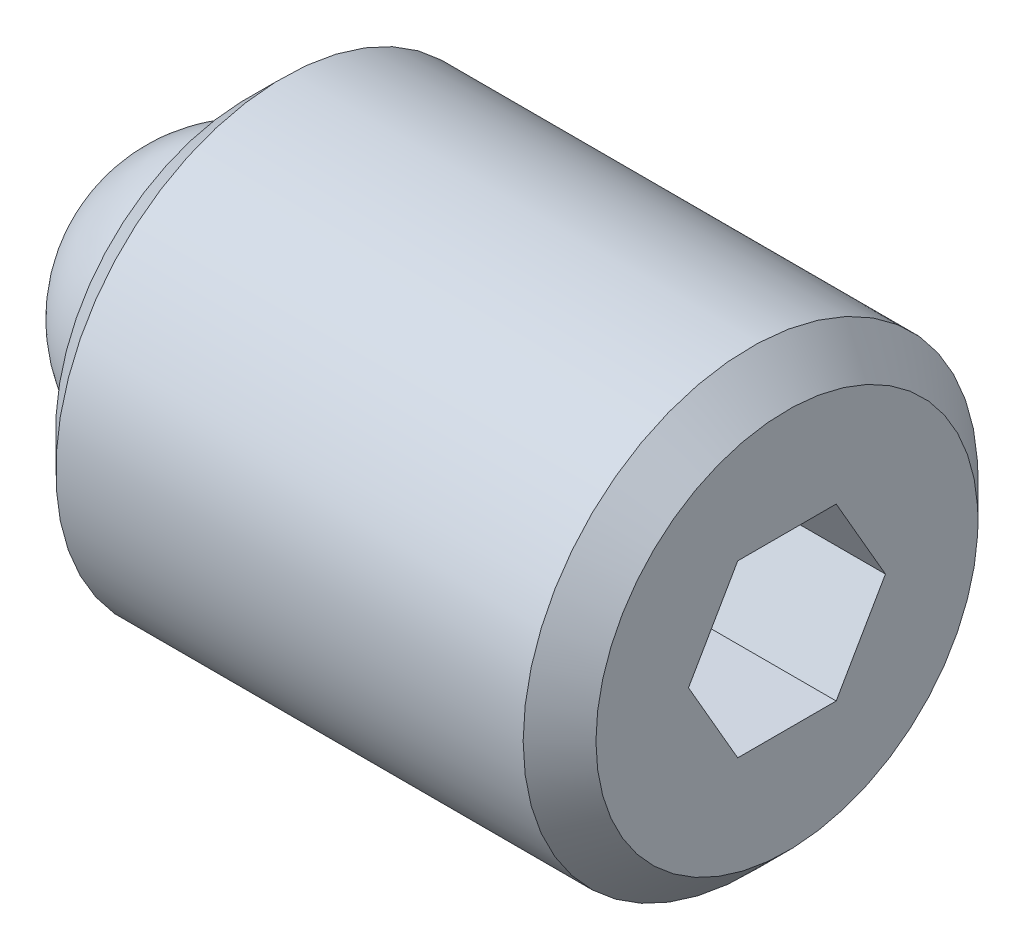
SolidWorks part; units mm, degrees
ref_plane "Front Plane" through (0, 0, 0) normal (0, 0, 1) x (1, 0, 0)
ref_plane "Top Plane" through (0, 0, 0) normal (0, 1, 0) x (1, 0, 0)
ref_plane "Right Plane" through (0, 0, 0) normal (1, 0, 0) x (0, 0, -1)
sketch "Sketch2" plane through (0, 0, 0) normal (1, 0, 0) x (0, 0, -1)
  circle A0 centre (0, 0) radius 3.175
  dimension "D1" = 6.35
extrude "Boss-Extrude1" add sketch "Sketch2" along normal blind 7.5406
sketch "Sketch3" plane through (0, 0, 0) normal (-1, 0, 0) x (0, 0, 1)
  circle A0 centre (0, 0) radius 1.9812
  dimension "D1" = 3.9624
chamfer "Chamfer1" distance 0.508 angle 45 1 edges at (0, 0, -3.175)
chamfer "Chamfer2" distance 0.508 angle 45 1 edges at (7.5406, 0, -3.175)
sketch "Sketch4" plane through (7.5406, 0, 0) normal (1, 0, 0) x (0, 0, -1)
  line L1 (1.3748, 0) -> (0.6874, 1.1906)
  line L2 (0.6874, 1.1906) -> (-0.6874, 1.1906)
  line L3 (-0.6874, 1.1906) -> (-1.3748, 0)
  line L4 (-1.3748, 0) -> (-0.6874, -1.1906)
  line L5 (-0.6874, -1.1906) -> (0.6874, -1.1906)
  line L6 (0.6874, -1.1906) -> (1.3748, 0)
  circle A0 centre (0, 0) radius 1.1906 construction
  dimension "D1" = 2.3813
extrude "Cut-Extrude2" cut sketch "Sketch4" against normal blind 2.286
extrude "Cut-Extrude3" cut sketch "Sketch3" against normal blind 1.9844
sketch "Sketch5" plane through (0, 0, 0) normal (-1, 0, 0) x (0, 0, 1)
  line L0 (0, 0) -> (0, -1.9844)
  line L1 (0, 0) -> (0, 1.9844)
  arc A0 (0, 1.9844) -> (0, -1.9844) centre (0, 0) ccw
  dimension "D1" = 1.9844
revolve "Revolve1" add sketch "Sketch5" angle 360 about L1
sketch "Sketch6" plane through (0, 0, 0) normal (-1, 0, 0) x (0, 0, 1)
  line L0 (0, 0) -> (0, 1.9812) construction
  circle A0 centre (0, 0) radius 1.9812 construction
  arc A1 (0.0635, 1.9802) -> (-0.0635, 1.9802) centre (0, 0) ccw
  arc A2 (0.0635, 1.9802) -> (-0.0635, 1.9802) centre (0, 1.9812) ccw
  dimension "D1" = 0.127
extrude "Cut-Extrude4" cut sketch "Sketch6" against normal up to surface (1.9844 mm away) contours A2 A1
